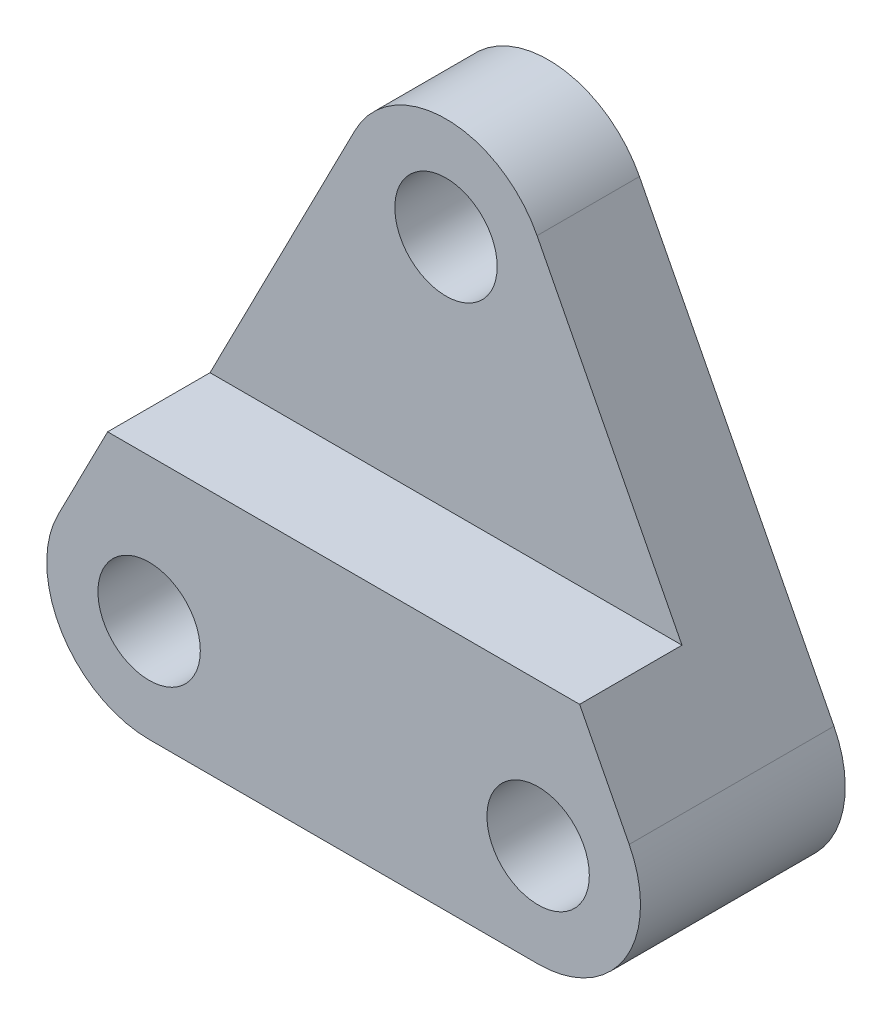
SolidWorks part; units mm, degrees
ref_plane "前视基准面" through (0, 0, 0) normal (0, 0, 1) x (1, 0, 0)
ref_plane "上视基准面" through (0, 0, 0) normal (0, 1, 0) x (1, 0, 0)
ref_plane "右视基准面" through (0, 0, 0) normal (1, 0, 0) x (0, 0, -1)
sketch "草图1" plane through (0, 0, 0) normal (0, 0, 1) x (1, 0, 0)
  line L0 (0, 0) -> (0, -59.806) construction
  line L1 (-42.7419, -37) -> (36.6842, -37) construction
  line L2 (-8.8957, 4.568) -> (-27.8957, -32.432)
  line L3 (-19, -47) -> (19, -47)
  line L4 (8.8957, 4.568) -> (27.8957, -32.432)
  circle A0 centre (0, 0) radius 5
  arc A1 (8.8957, 4.568) -> (-8.8957, 4.568) centre (0, 0) ccw
  circle A2 centre (-19, -37) radius 5
  circle A3 centre (19, -37) radius 5
  arc A4 (-27.8957, -32.432) -> (-19, -47) centre (-19, -37) ccw
  arc A5 (19, -47) -> (27.8957, -32.432) centre (19, -37) ccw
  dimension "D1" = 37
  dimension "D2" = 19
  dimension "D4" = 20
  dimension "D5" = 20
  dimension "D6" = 20
  dimension "D3" = 19
extrude "拉伸1" add sketch "草图1" along normal blind 10
sketch "草图2" plane through (0, 0, 10) normal (0, 0, 1) x (1, 0, 0)
  line L0 (-23.0522, -23) -> (23.0522, -23)
  line L1 (-8.8957, 4.568) -> (-27.8957, -32.432) construction
  line L2 (27.8957, -32.432) -> (8.8957, 4.568) construction
  line L3 (23.0522, -23) -> (27.8957, -32.432)
  line L4 (-23.0522, -23) -> (-27.8957, -32.432)
  line L5 (19, -47) -> (-19, -47)
  circle A0 centre (19, -37) radius 5
  arc A1 (-27.8957, -32.432) -> (-19, -47) centre (-19, -37) ccw
  circle A2 centre (-19, -37) radius 5
  arc A3 (19, -47) -> (27.8957, -32.432) centre (19, -37) ccw
  dimension "D1" = 14
extrude "拉伸2" add sketch "草图2" along normal blind 10
